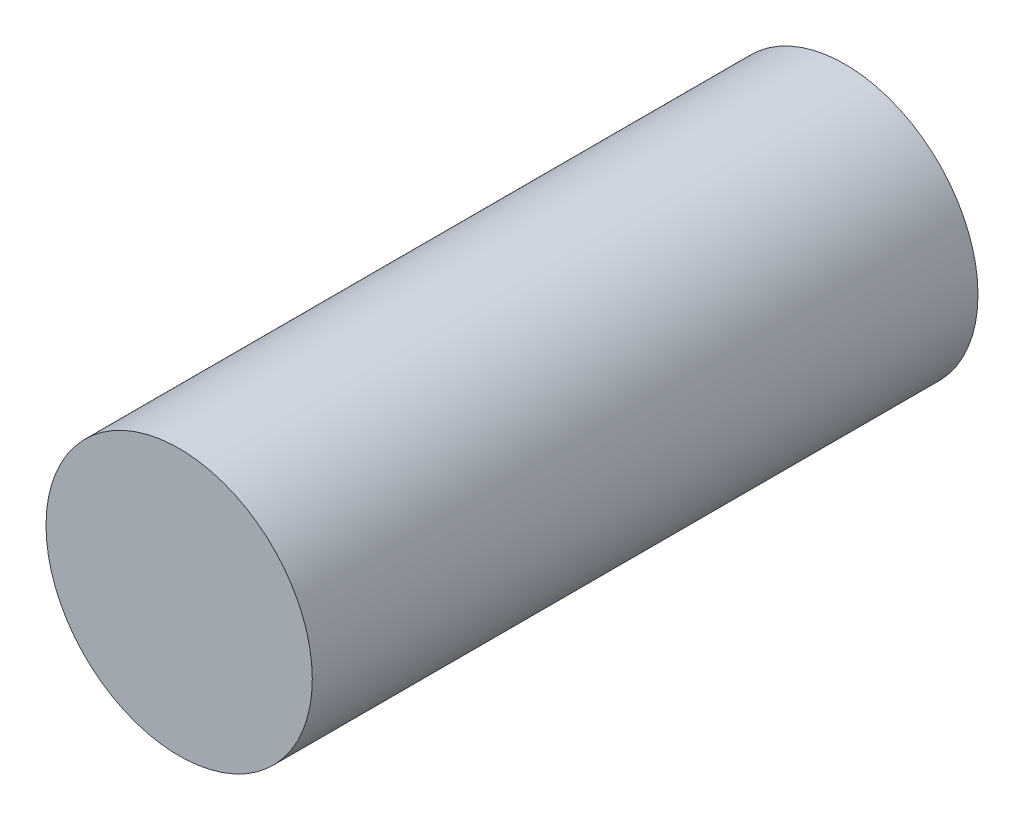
SolidWorks part; units mm, degrees
ref_plane "Front Plane" through (0, 0, 0) normal (0, 0, 1) x (1, 0, 0)
ref_plane "Top Plane" through (0, 0, 0) normal (0, 1, 0) x (1, 0, 0)
ref_plane "Right Plane" through (0, 0, 0) normal (1, 0, 0) x (0, 0, -1)
sketch "Sketch1" plane through (0, 0, 0) normal (0, 0, 1) x (1, 0, 0)
  circle A0 centre (-67.7571, 12.5377) radius 3.175
  dimension "D1" = 6.35
extrude "Boss-Extrude1" add sketch "Sketch1" along normal blind 15.875
